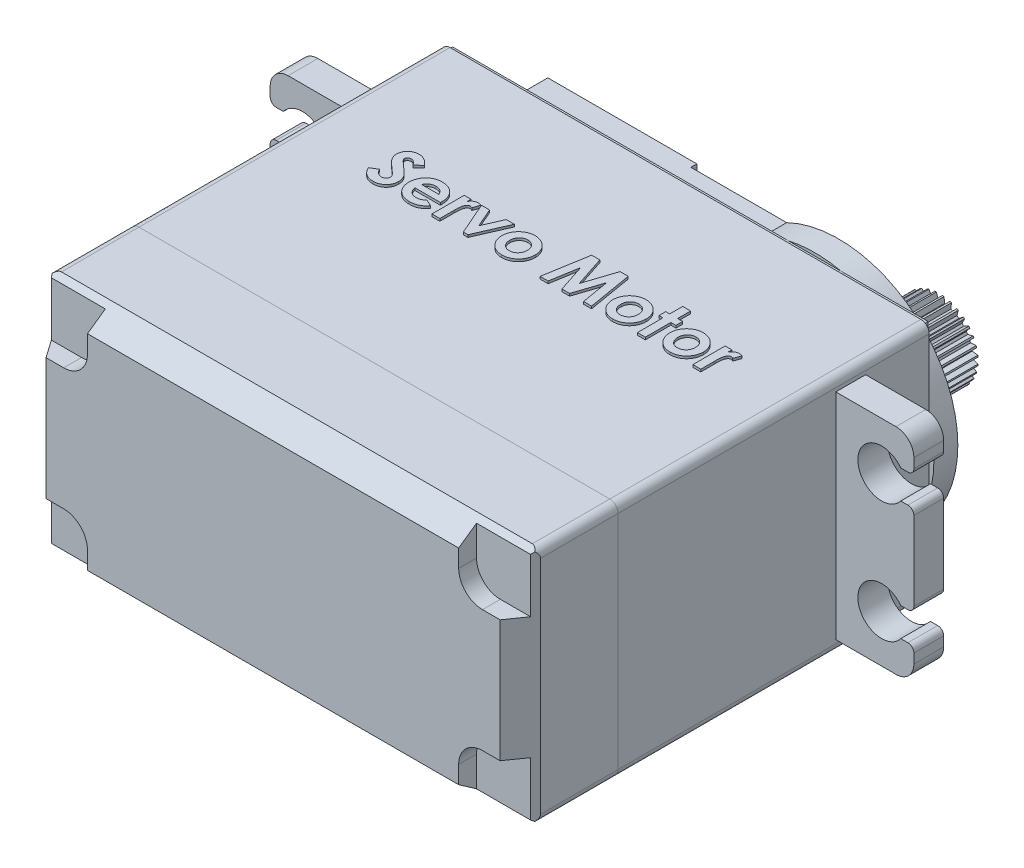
SolidWorks part; units mm, degrees
ref_plane "Front Plane" through (0, 0, 0) normal (0, 0, 1) x (1, 0, 0)
ref_plane "Top Plane" through (0, 0, 0) normal (0, 1, 0) x (1, 0, 0)
ref_plane "Right Plane" through (0, 0, 0) normal (1, 0, 0) x (0, 0, -1)
sketch "Sketch1" plane through (0, 0, 0) normal (0, 0, 1) x (1, 0, 0)
  line L1 (20.45, 10) -> (-20.45, 10)
  line L2 (20.45, 10) -> (20.45, -10)
  line L3 (20.45, -10) -> (-20.45, -10)
  line L4 (-20.45, 10) -> (-20.45, -10)
  line L5 (20.45, 10) -> (-20.45, -10) construction
  line L6 (20.45, -10) -> (-20.45, 10) construction
  point P0 (0, 0)
  dimension "D1" = 20
  dimension "D2" = 40.9
extrude "Boss-Extrude1" add sketch "Sketch1" along normal blind 19.3
sketch "Sketch2" plane through (0, 0, 0) normal (0, 0, -1) x (-1, 0, 0)
  line L4 (20.45, -10) -> (20.45, 10)
  line L5 (20.45, 10) -> (-20.45, 10)
  line L6 (-20.45, 10) -> (-20.45, -10)
  line L7 (-20.45, -10) -> (20.45, -10)
  line L8 (20.45, -10) -> (20.45, 10)
  line L9 (20.45, 10) -> (-20.45, 10)
  line L10 (-20.45, 10) -> (-20.45, -10)
  line L11 (-20.45, -10) -> (20.45, -10)
  dimension "D1" = 0
extrude "Boss-Extrude2" add sketch "Sketch2" along normal blind 6.8 separate body
sketch "Sketch3" plane through (0, 0, 19.3) normal (0, 0, 1) x (1, 0, 0)
  line L4 (-20.45, 10) -> (-20.45, -10)
  line L5 (-20.45, -10) -> (20.45, -10)
  line L6 (20.45, -10) -> (20.45, 10)
  line L7 (20.45, 10) -> (-20.45, 10)
  line L8 (-20.45, 10) -> (-20.45, -10)
  line L9 (-20.45, -10) -> (20.45, -10)
  line L10 (20.45, -10) -> (20.45, 10)
  line L11 (20.45, 10) -> (-20.45, 10)
  dimension "D1" = 0
extrude "Boss-Extrude3" add sketch "Sketch3" along normal blind 8.5 separate body
chamfer "Chamfer1" distance 2 angle 35 4 edges at (20.45, 0, 27.8) (0, -10, 27.8) (-20.45, 0, 27.8) (0, 10, 27.8)
sketch "Sketch4" plane through (0, 0, 27.8) normal (0, 0, 1) x (1, 0, 0)
  line L0 (0, 0) -> (0, 10) construction
  line L1 (-20.45, 10) -> (-15.57, 10)
  line L2 (-20.45, 10) -> (-20.45, 5.12)
  line L3 (-20.45, 5.12) -> (-17.57, 5.12)
  line L4 (-15.57, 10) -> (-15.57, 7.12)
  line L5 (-20.45, 10) -> (20.45, 10) construction
  line L6 (0, 0) -> (20.45, 0) construction
  line L7 (20.45, 10) -> (20.45, -10) construction
  line L8 (15.57, 10) -> (15.57, 7.12)
  line L9 (20.45, 5.12) -> (17.57, 5.12)
  line L10 (20.45, 10) -> (20.45, 5.12)
  line L11 (20.45, 10) -> (15.57, 10)
  line L12 (-15.57, -10) -> (-15.57, -7.12)
  line L13 (-20.45, -5.12) -> (-17.57, -5.12)
  line L14 (-20.45, -10) -> (-20.45, -5.12)
  line L15 (-20.45, -10) -> (-15.57, -10)
  line L16 (20.45, -10) -> (15.57, -10)
  line L17 (20.45, -10) -> (20.45, -5.12)
  line L18 (20.45, -5.12) -> (17.57, -5.12)
  line L19 (15.57, -10) -> (15.57, -7.12)
  arc A0 (-17.57, 5.12) -> (-15.57, 7.12) centre (-17.57, 7.12) ccw
  arc A1 (17.57, 5.12) -> (15.57, 7.12) centre (17.57, 7.12) cw
  arc A2 (-17.57, -5.12) -> (-15.57, -7.12) centre (-17.57, -7.12) cw
  arc A3 (17.57, -5.12) -> (15.57, -7.12) centre (17.57, -7.12) ccw
  dimension "D3" = 2
  dimension "D1" = 4.88
  dimension "D2" = 4.88
extrude "Cut-Extrude1" cut sketch "Sketch4" against normal blind 1.5
sketch "Sketch5" plane through (0, 0, -6.8) normal (0, 0, -1) x (-1, 0, 0)
  line L1 (19.95, 9.75) -> (-19.95, 9.75)
  line L2 (19.95, 9.75) -> (19.95, -9.75)
  line L3 (19.95, -9.75) -> (-19.95, -9.75)
  line L4 (-19.95, 9.75) -> (-19.95, -9.75)
  line L5 (19.95, 9.75) -> (-19.95, -9.75) construction
  line L6 (19.95, -9.75) -> (-19.95, 9.75) construction
  line L7 (20.45, 10) -> (-20.45, 10) construction
  line L8 (20.45, -10) -> (20.45, 10) construction
  point P0 (0, 0)
  dimension "D1" = 0.25
  dimension "D2" = 0.5
extrude "Boss-Extrude4" add sketch "Sketch5" along normal blind 0.4
sketch "Sketch7" plane through (0, 0, -7.2) normal (0, 0, -1) x (-1, 0, 0)
  line L0 (-20.45, 0) -> (20.45, 0) construction
  line L1 (-20.45, 10) -> (-20.45, -10) construction
  line L2 (20.45, -10) -> (20.45, 10) construction
  line L3 (20.45, 10) -> (-20.45, 10) construction
  line L4 (-6.09, 9.75) -> (-6.09, -9.75) construction
  line L5 (19.95, 9.75) -> (-19.95, 9.75) construction
  line L6 (-19.95, -9.75) -> (19.95, -9.75) construction
  line L7 (-6.09, 8.9995) -> (14.45, 8.9995)
  line L8 (14.45, 8.9995) -> (14.45, 3.9188)
  line L9 (14.45, -8.9995) -> (14.45, -3.9188)
  line L10 (-6.09, -8.9995) -> (14.45, -8.9995)
  arc A0 (-6.09, 8.9995) -> (-6.09, -8.9995) centre (-10.45, 0) ccw
  arc A1 (14.45, -3.9188) -> (14.45, 3.9188) centre (13.3905, 0) ccw
  point P23 (17.45, 0)
  dimension "D1" = 14.36
  dimension "D2" = 6
  dimension "D3" = 3
extrude "Boss-Extrude5" add sketch "Sketch7" along normal blind 2
sketch "Sketch8" plane through (0, 0, -9.2) normal (0, 0, -1) x (-1, 0, 0)
  circle A0 centre (-11.9002, 0) radius 6.5
  dimension "D1" = 13
extrude "Boss-Extrude6" add sketch "Sketch8" along normal blind 1.5
sketch "Sketch9" plane through (0, 0, -10.7) normal (0, 0, -1) x (-1, 0, 0)
  circle A0 centre (-11.9002, 0) radius 5.5
  dimension "D1" = 11
extrude "Boss-Extrude7" add sketch "Sketch9" along normal blind 0.5
sketch "Sketch10" plane through (0, 0, -11.2) normal (0, 0, -1) x (-1, 0, 0)
  circle A0 centre (-11.9002, 0) radius 3.25
  dimension "D1" = 6.5
extrude "Boss-Extrude8" add sketch "Sketch10" along normal blind 5
sketch "Sketch11" plane through (0, 0, -9.2) normal (0, 0, -1) x (-1, 0, 0)
  line L0 (-6.09, -8.9995) -> (14.45, -8.9995) construction
  line L1 (14.45, 8.9995) -> (1.95, 8.9995)
  line L2 (14.45, 8.9995) -> (14.45, -8.9995)
  line L3 (14.45, -8.9995) -> (1.95, -8.9995)
  line L4 (1.95, 8.9995) -> (1.95, 1.75)
  line L5 (13.45, 7.9995) -> (2.95, 7.9995)
  line L6 (2.95, 7.9995) -> (2.95, -7.9995)
  line L7 (13.45, -7.9995) -> (2.95, -7.9995)
  line L8 (13.45, 7.9995) -> (13.45, -7.9995)
  line L9 (1.95, -1.75) -> (1.95, -8.9995)
  line L10 (1.95, 8.9995) -> (1.95, -8.9995) construction
  arc A0 (1.95, 1.75) -> (1.95, -1.75) centre (1.95, 0) ccw
  dimension "D3" = 3.5
  dimension "D1" = 12.5
  dimension "D2" = 1
extrude "Boss-Extrude9" add sketch "Sketch11" along normal blind 0.5
fillet "Fillet1" radius 0.7 4 edges at (-20.45, -10, 9.65) (-20.45, 10, 9.65) (20.45, 10, 9.65) (20.45, -10, 9.65)
fillet "Fillet2" radius 0.7 4 edges at (20.45, 10, -3.4) (-20.45, 10, -3.4) (-20.45, -10, -3.4) (20.45, -10, -3.4)
fillet "Fillet3" radius 0.7 4 edges at (-20.45, 10, 22.55) (-20.45, -10, 22.55) (20.45, 10, 22.55) (20.45, -10, 22.55)
sketch "Sketch12" plane through (0, 0, -7.2) normal (0, 0, -1) x (-1, 0, 0)
  line L0 (20.45, 9) -> (25.5, 9)
  line L1 (20.45, -9.3) -> (20.45, 9.3) construction
  line L2 (0, 0) -> (30.9499, 0) construction
  line L3 (27, 7.5) -> (27, 6.7)
  line L4 (19.75, 10) -> (-19.75, 10) construction
  line L5 (0, 8.9995) -> (0, -8.9995) construction
  line L6 (1.95, 8.9995) -> (-6.09, 8.9995) construction
  line L7 (-6.09, -8.9995) -> (1.95, -8.9995) construction
  line L8 (25.9, 9) -> (25.9, 0) construction
  line L9 (25.9, 6.2) -> (26.5, 6.2)
  line L10 (25.9, 3.8) -> (26.5, 3.8)
  line L11 (27, 3.3) -> (27, -3.3)
  line L12 (25.9, -3.8) -> (26.5, -3.8)
  line L13 (25.9, -6.2) -> (26.5, -6.2)
  line L14 (27, -7.5) -> (27, -6.7)
  line L15 (20.45, -9) -> (25.5, -9)
  line L16 (20.45, 9) -> (20.45, -9)
  arc A0 (25.9, 6.2) -> (25.9, 3.8) centre (24.3, 5) ccw
  arc A1 (26.5, 3.8) -> (27, 3.3) centre (26.5, 3.3) cw
  arc A2 (26.5, 6.2) -> (27, 6.7) centre (26.5, 6.7) ccw
  arc A3 (25.5, 9) -> (27, 7.5) centre (25.5, 7.5) cw
  arc A4 (25.5, -9) -> (27, -7.5) centre (25.5, -7.5) ccw
  arc A5 (26.5, -6.2) -> (27, -6.7) centre (26.5, -6.7) cw
  arc A6 (26.5, -3.8) -> (27, -3.3) centre (26.5, -3.3) ccw
  arc A7 (25.9, -6.2) -> (25.9, -3.8) centre (24.3, -5) cw
  point P25 (27, 3.8)
  point P42 (27, 0)
  point P43 (27, -3.8)
  dimension "D3" = 4
  dimension "D7" = 0.5
  dimension "D8" = 1.5
  dimension "D1" = 6.55
  dimension "D2" = 1
  dimension "D4" = 5
  dimension "D5" = 24.3
  dimension "D6" = 1.1
extrude "Boss-Extrude10" add sketch "Sketch12" against normal blind 2.5 from offset 5.74
mirror "Mirror1" about plane through (0, 0, 0) normal (1, 0, 0) of "Boss-Extrude10"
sketch "Sketch13" plane through (0, -10, 0) normal (0, -1, 0) x (1, 0, 0)
  line L0 (-19.75, 6.25) -> (20.45, 6.25) construction
  line L1 (-19.75, 19.3) -> (-19.75, -6.8) construction
  line L2 (20.45, 19.3) -> (20.45, -6.8) construction
  text T0 "Servo Motor" font "Century Gothic" height in points 14
extrude "Boss-Extrude11" add sketch "Sketch13" against normal blind 0.2 from surface at -20
sketch "Sketch14" plane through (0, -10, 0) normal (0, -1, 0) x (1, 0, 0)
  line L0 (-19.75, 6.25) -> (20.45, 6.25) construction
  line L1 (-19.75, 19.3) -> (-19.75, -6.8) construction
  line L2 (20.45, 19.3) -> (20.45, -6.8) construction
  text T0 "Servo Motor" font "Century Gothic" height in points 14
extrude "Boss-Extrude12" add sketch "Sketch14" along normal blind 0.2
sketch "Sketch15" plane through (0, 0, -16.2) normal (0, 0, -1) x (-1, 0, 0)
  line L0 (-11.9002, 0) -> (-11.9002, 3.25) construction
  line L1 (-11.8002, 2.7882) -> (-11.6502, 3.2404)
  line L2 (-12.0002, 2.7882) -> (-12.1502, 3.2404)
  arc A0 (-11.8002, 2.7882) -> (-12.0002, 2.7882) centre (-11.9002, 0) ccw
  circle A1 centre (-11.9002, 0) radius 3.25 construction
  arc A2 (-11.6502, 3.2404) -> (-12.1502, 3.2404) centre (-11.9002, 0) ccw
  dimension "D1" = 5.58
  dimension "D2" = 0.25
  dimension "D3" = 0.1
extrude "Cut-Extrude2" cut sketch "Sketch15" against normal up to surface (5 mm away)
pattern_circular "CirPattern3" count 32 over 360 about axis through (11.9002, 0, 0) along (0, 0, 1) of "Cut-Extrude2"
